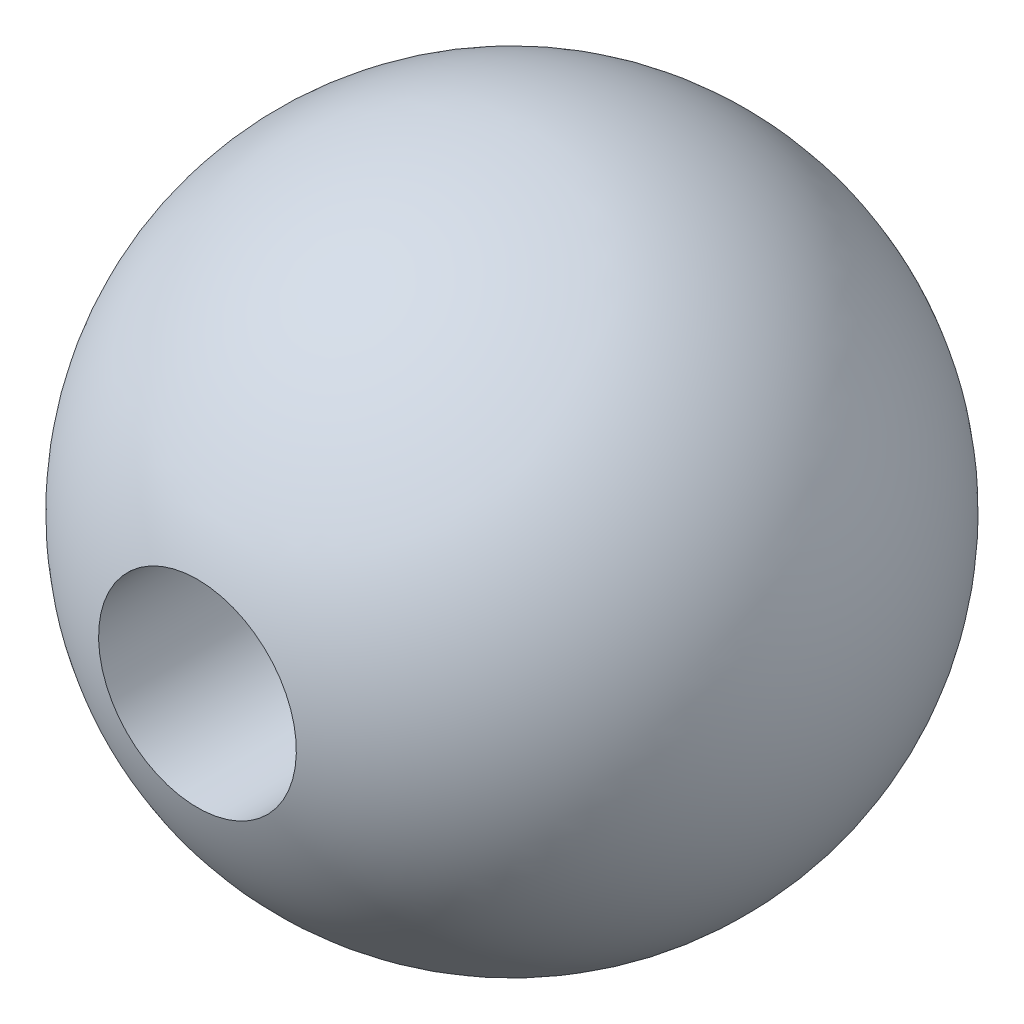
SolidWorks part; units mm, degrees
ref_plane "Alzado" through (0, 0, 0) normal (0, 0, 1) x (1, 0, 0)
ref_plane "Planta" through (0, 0, 0) normal (0, 1, 0) x (1, 0, 0)
ref_plane "Vista lateral" through (0, 0, 0) normal (1, 0, 0) x (0, 0, -1)
sketch "Croquis1" plane through (0, 0, 0) normal (1, 0, 0) x (0, 0, -1)
  line L0 (-64.1808, 0) -> (60.3145, 0) construction
  line L1 (-50, 0) -> (50, 0)
  arc A0 (50, 0) -> (-50, 0) centre (0, 0) ccw
revolve "Revolución1" add sketch "Croquis1" angle 360 about L0
sketch "Croquis2" plane through (0, 0, 0) normal (0, 0, 1) x (1, 0, 0)
  circle A0 centre (0, 0) radius 15
extrude "Cortar-Extruir1" cut sketch "Croquis2" against normal through all both and the other way through all
